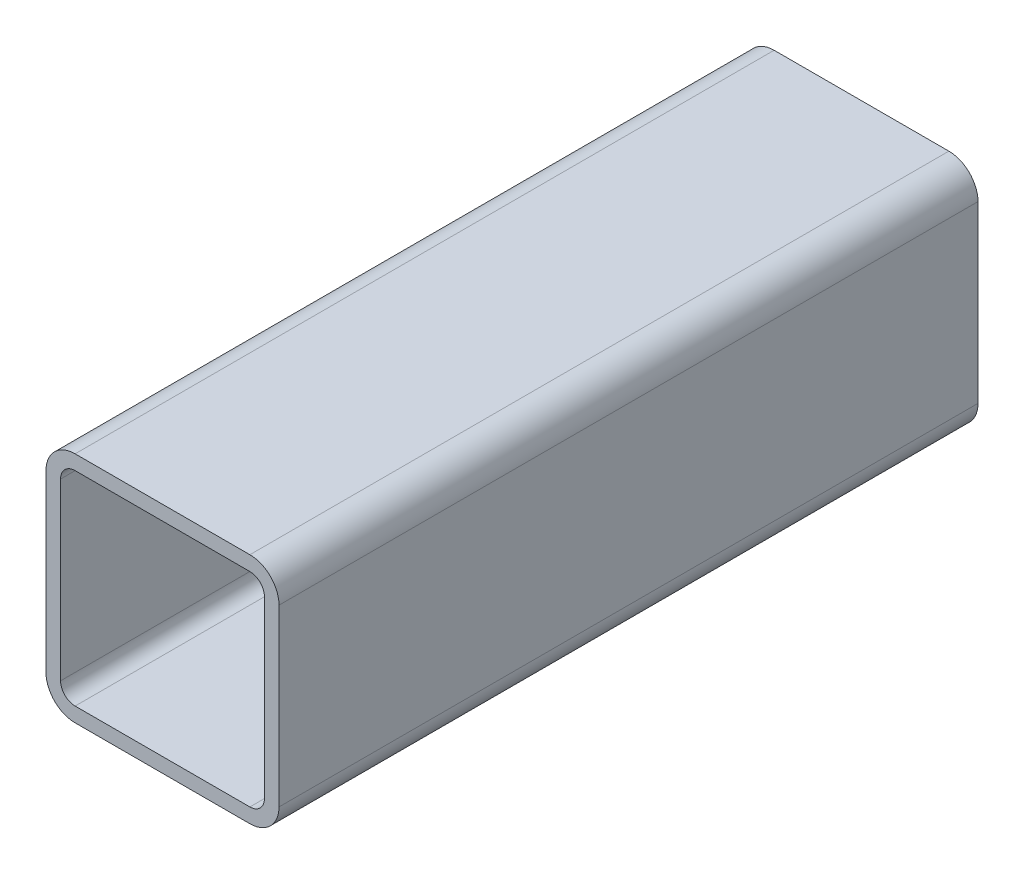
SolidWorks part; units mm, degrees
ref_plane "Front Plane" through (0, 0, 0) normal (0, 0, 1) x (1, 0, 0)
ref_plane "Top Plane" through (0, 0, 0) normal (0, 1, 0) x (1, 0, 0)
ref_plane "Right Plane" through (0, 0, 0) normal (1, 0, 0) x (0, 0, -1)
sketch "Sketch1" plane through (0, 0, 0) normal (0, 0, 1) x (1, 0, 0)
sketch_block_instance "HSS4x4x0.250-1"
sketch_block "HSS4x4x0.250"
extrude "Boss-Extrude1" add sketch "Sketch1" along normal blind 304.8
